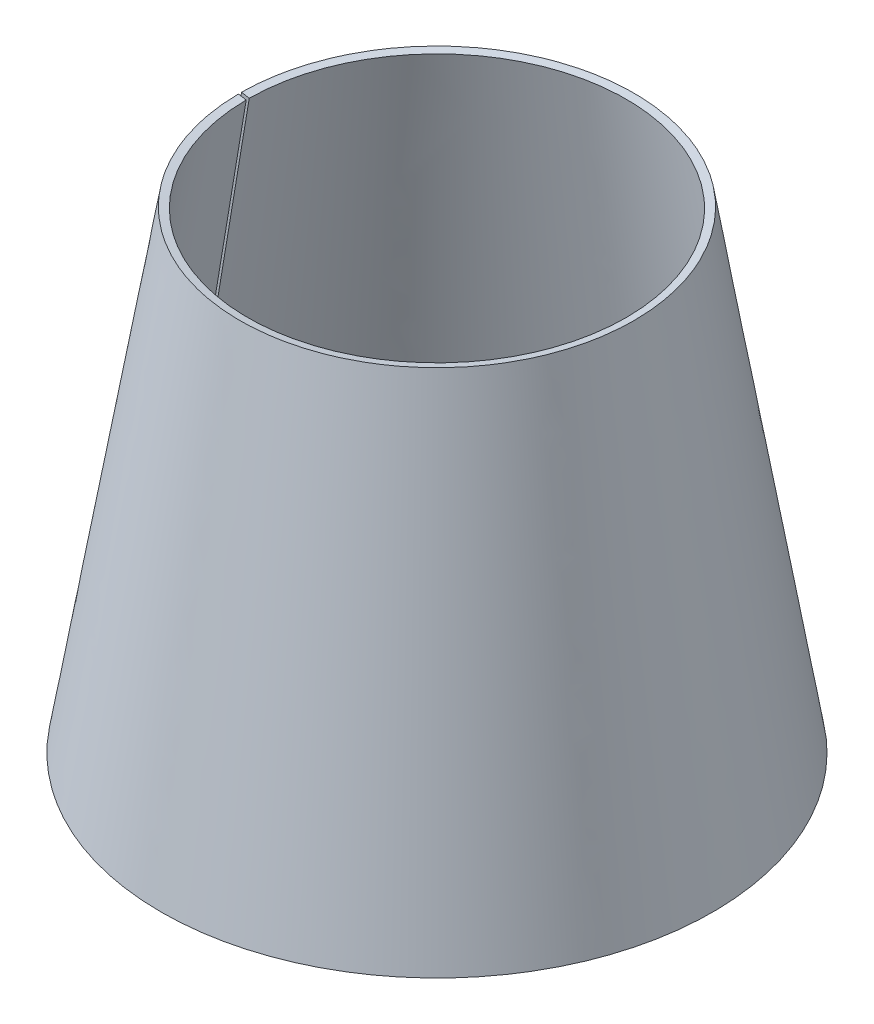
SolidWorks part; units mm, degrees
ref_plane "Ebene vorne" through (0, 0, 0) normal (0, 0, 1) x (1, 0, 0)
ref_plane "Ebene oben" through (0, 0, 0) normal (0, 1, 0) x (1, 0, 0)
ref_plane "Ebene rechts" through (0, 0, 0) normal (1, 0, 0) x (0, 0, -1)
sketch "Skizze1" plane through (0, 0, 0) normal (0, 1, 0) x (1, 0, 0)
  line L0 (0, 0) -> (-175, 0) construction
  line L1 (-173.4235, 1) -> (-174.9971, 1) construction
  line L2 (-173.4235, -1) -> (-174.9971, -1) construction
  arc A0 (-174.9971, -1) -> (-174.9971, 1) centre (0, 0) ccw
  dimension "D1" = 350
  dimension "D2" = 2
ref_plane "Ebene1" through (0, 300, 0) normal (0, 1, 0) x (-1, 0, 0)
sketch "Skizze2" plane through (0, 300, 0) normal (0, 1, 0) x (-1, 0, 0)
  line L0 (173.4235, -1) -> (124.996, -1) construction
  line L1 (173.4235, 1) -> (124.996, 1) construction
  arc A0 (124.996, 1) -> (124.996, -1) centre (0, 0) ccw
  dimension "D1" = 250
sheet metal parameters "Blech1" thickness 5 parameters "D1"=6, "Dicke"=5
lofted bend "Ausgeformte Biegungen1" parameters "D1"=0, "D12"=5
other "Freiform-Biegung1" parameters "D1"=1000, "D4"=57.296, "D5"=1
flat pattern "Abwicklung1"
sketch "Biegung-Linien1" plane through (0, 0, 0) normal (0, 1, 0) x (-1, 0, 0)
other "Abwickeln-<Freiform-Biegung1>1"
